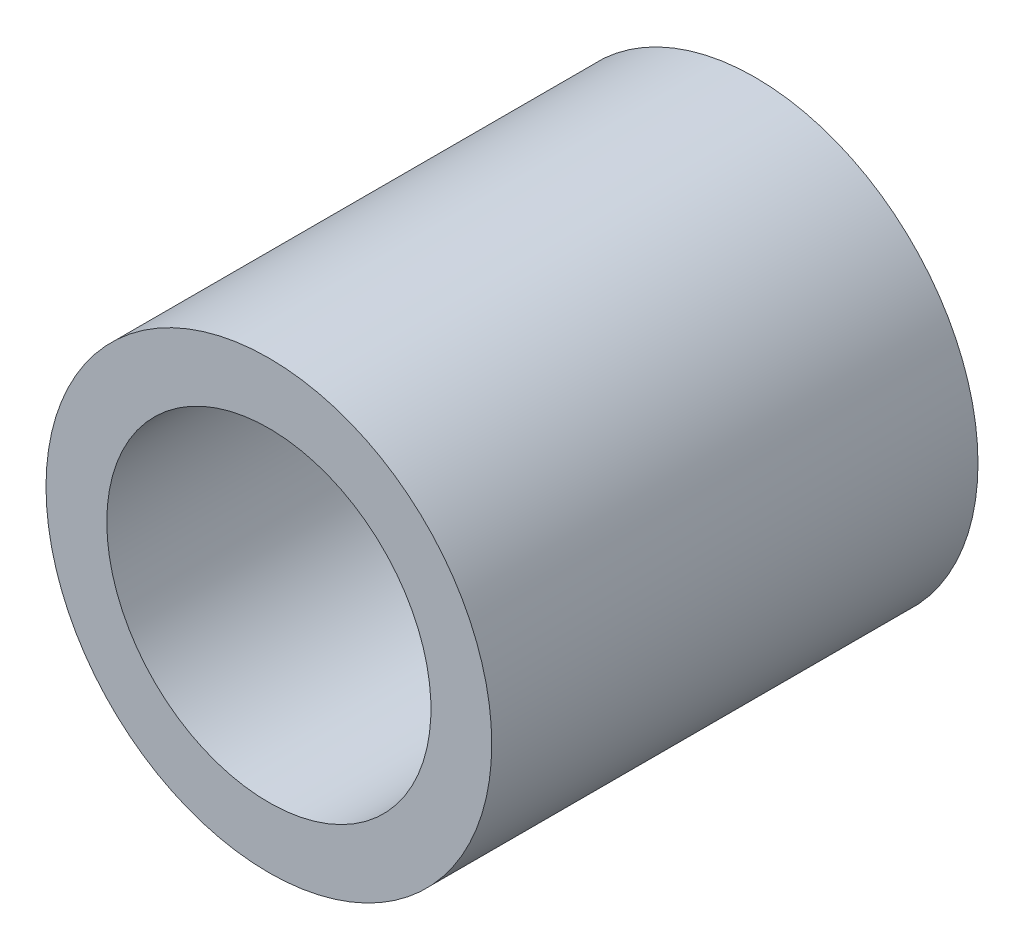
SolidWorks part; units mm, degrees
ref_plane "Front Plane" through (0, 0, 0) normal (0, 0, 1) x (1, 0, 0)
ref_plane "Top Plane" through (0, 0, 0) normal (0, 1, 0) x (1, 0, 0)
ref_plane "Right Plane" through (0, 0, 0) normal (1, 0, 0) x (0, 0, -1)
sketch "Sketch1" plane through (0, 0, 0) normal (0, 0, 1) x (1, 0, 0)
  circle A0 centre (0, 0) radius 8.7312
  circle A1 centre (0, 0) radius 6.35
  dimension "D1" = 17.4625
  dimension "D2" = 12.7
extrude "Extrude1" add sketch "Sketch1" along normal blind 19.05
